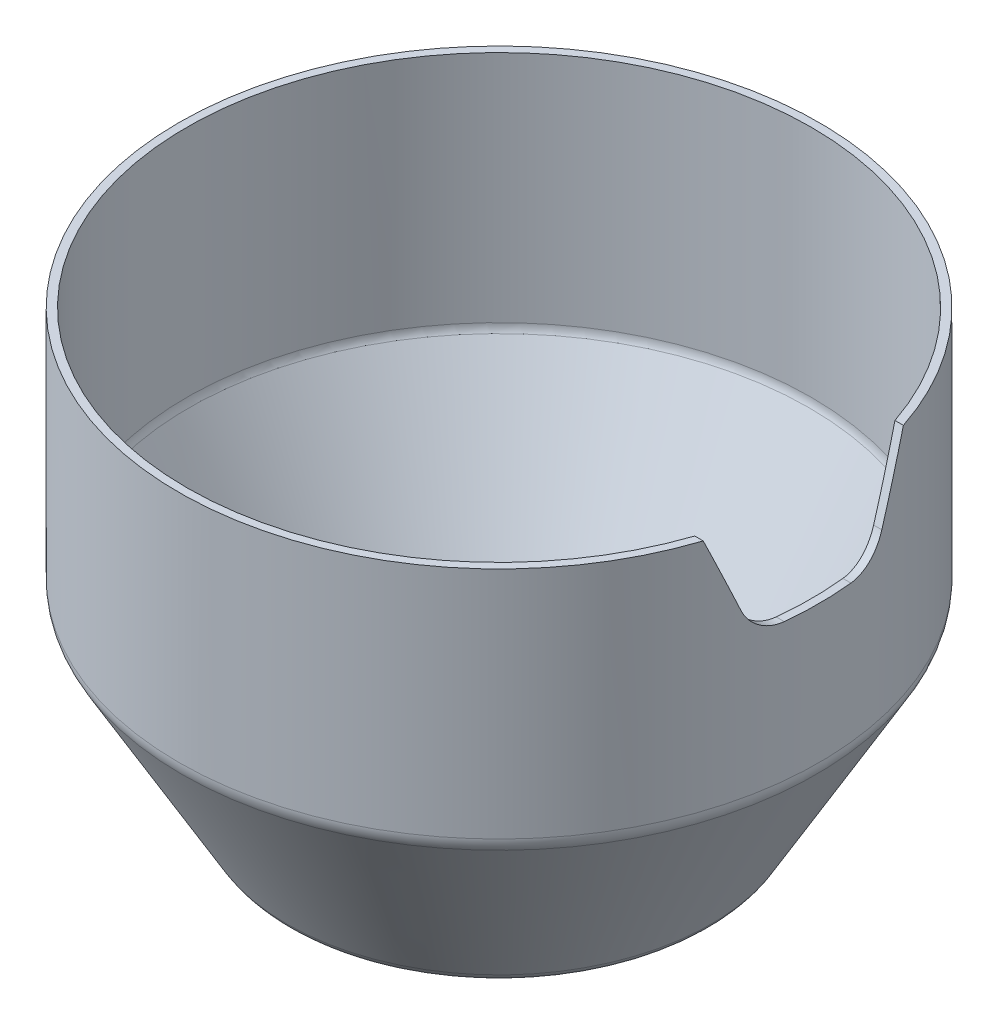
SolidWorks part; units mm, degrees
ref_plane "Plan de face" through (0, 0, 0) normal (0, 0, 1) x (1, 0, 0)
ref_plane "Plan de dessus" through (0, 0, 0) normal (0, 1, 0) x (1, 0, 0)
ref_plane "Plan de droite" through (0, 0, 0) normal (1, 0, 0) x (0, 0, -1)
sketch "Esquisse1" plane through (0, 0, 0) normal (0, 0, 1) x (1, 0, 0)
  line L0 (0, 0) -> (0, 95.1243) construction
  line L1 (0, 0) -> (25.5774, 0)
  line L2 (25.5774, 0) -> (40, 24.9808)
  line L3 (40, 24.9808) -> (40, 55)
  line L4 (40, 55) -> (39, 55)
  line L5 (39, 55) -> (39, 25.2487)
  line L6 (39, 25.2487) -> (25, 1)
  line L7 (25, 1) -> (0, 1)
  line L8 (0, 1) -> (0, 0)
  dimension "D1" = 39
  dimension "D2" = 1
  dimension "D3" = 55
  dimension "D4" = 1
  dimension "D5" = 30
  dimension "D6" = 1
  dimension "D7" = 25
revolve "Révolution1" add sketch "Esquisse1" angle 360 about L0
fillet "Congé1" radius 3 2 edges at (0, 0, -25.5774) (0, 24.9808, -40)
fillet "Congé2" radius 2 2 edges at (0, 25.2487, -39) (0, 1, -25)
sketch "Esquisse2" plane through (0, 0, 0) normal (0, -1, 0) x (1, 0, 0)
  line L0 (0, 18) -> (0, -18) construction
  circle A0 centre (0, 0) radius 11
  circle A1 centre (0, 18) radius 3
  circle A2 centre (0, -18) radius 3
  dimension "D1" = 22
  dimension "D2" = 6
  dimension "D3" = 6
  dimension "D4" = 36
extrude "Enlèv. mat.-Extru.1" cut sketch "Esquisse2" against normal through all
sketch "Esquisse3" plane through (0, 0, 0) normal (1, 0, 0) x (0, 0, -1)
  line L0 (0, 0) -> (0, 63.0184) construction
  line L1 (-12.5, 55) -> (-7.5, 43)
  line L2 (40, 55) -> (-40, 55) construction
  line L3 (-7.5, 43) -> (7.5, 43)
  line L4 (7.5, 43) -> (12.5, 55)
  line L5 (12.5, 55) -> (-12.5, 55)
  line L7 (23.8453, 1) -> (-23.8453, 1) construction
  dimension "D1" = 42
  dimension "D2" = 15
  dimension "D3" = 25
extrude "Enlèv. mat.-Extru.2" cut sketch "Esquisse3" along normal through all
fillet "Congé3" radius 5 2 edges at (38.7813, 43, -7.5) (38.7813, 43, 7.5)
sketch "Esquisse4" plane through (0, 0, 0) normal (0, 1, 0) x (1, 0, 0)
  line L0 (0, 0) -> (-46, 0) construction
  line L1 (-46, 40) -> (-26, 40)
  line L2 (-46, 40) -> (-46, -40)
  line L3 (-46, -40) -> (-26, -40)
  line L4 (-26, 40) -> (-26, -40)
  dimension "D1" = 26
  dimension "D2" = 20
  dimension "D3" = 80
extrude "Enlèv. mat.-Extru.3" cut sketch "Esquisse4" along normal through all
